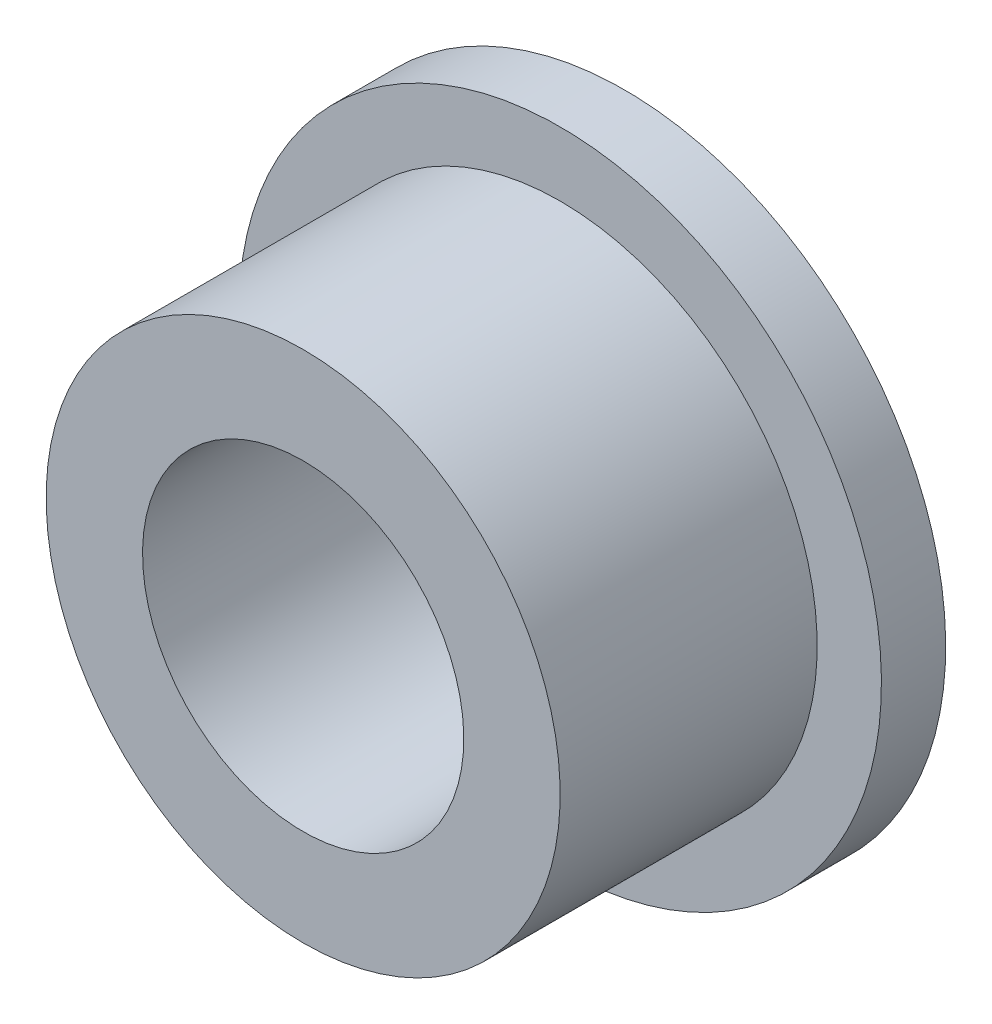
SolidWorks part; units mm, degrees
ref_plane "Front Plane" through (0, 0, 0) normal (0, 0, 1) x (1, 0, 0)
ref_plane "Top Plane" through (0, 0, 0) normal (0, 1, 0) x (1, 0, 0)
ref_plane "Right Plane" through (0, 0, 0) normal (1, 0, 0) x (0, 0, -1)
imported_body "Imported1"
other "Move Face1" parameters "D1"=2.5
sketch "Sketch1" plane through (0, 0, 0) normal (0, 0, 1) x (1, 0, 0)
  line L0 (-1.905, 0) -> (1.905, 0)
  line L1 (0, -1.905) -> (0, 1.905)
  circle A0 centre (0, 0) radius 2.85
  circle A1 centre (0, 0) radius 1
  circle A2 centre (0, 0) radius 2.75
  circle A3 centre (0, 0) radius 2.75
  text T0 "B" font "ARIAL" height 1
  text T1 "NC" font "COURIER NEW" height 0.508
move or copy body "Body-Move/Copy1" bodies to move or copy 102 copy no rotation origin (0, -0.75, 0) rotation axis (-1, 0, 0) rotation angle 90
move or copy body "Body-Move/Copy2" bodies to move or copy 103 copy no translate (0, 0.75, 0)
move or copy body "Body-Move/Copy3" bodies to move or copy 104 copy no translate (0, 0, 1.25)
